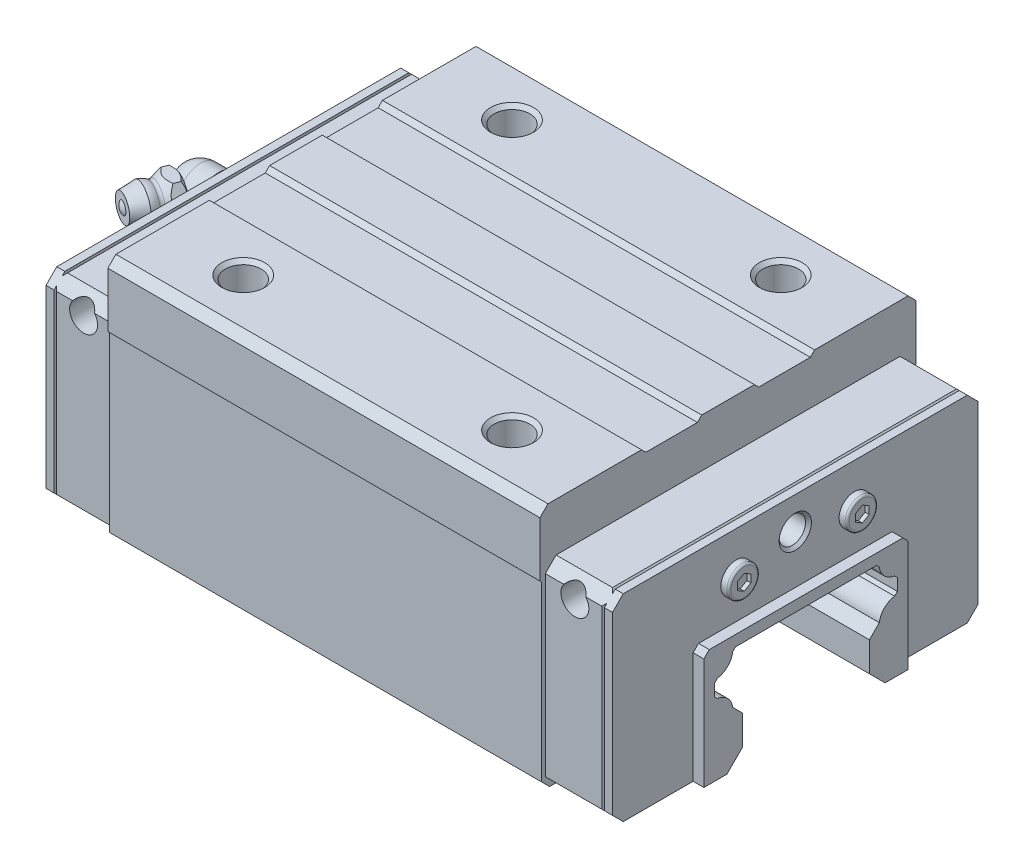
SolidWorks part; units mm, degrees
ref_plane "Front Plane" through (0, 0, 0) normal (0, 0, 1) x (1, 0, 0)
ref_plane "Top Plane" through (0, 0, 0) normal (0, 1, 0) x (1, 0, 0)
ref_plane "Right Plane" through (0, 0, 0) normal (1, 0, 0) x (0, 0, -1)
imported_body "HSR35R1SS-280L_G20_0_B-M6F_72-6_0_0_0_1(R2).stp-1/_HSR35RSSB-M6F1 Slider-1-R2.stp-1-solid1"
imported_body "HSR35R1SS-280L_G20_0_B-M6F_72-6_0_0_0_1(R2).stp-1/_hsr_ftht_B-M6F_grease_nipple_joint.stp-1-solid1"
move or copy body "Body-Move/Copy1" bodies to move or copy 104 103 copy no translate (-107.3, 0, 0)
